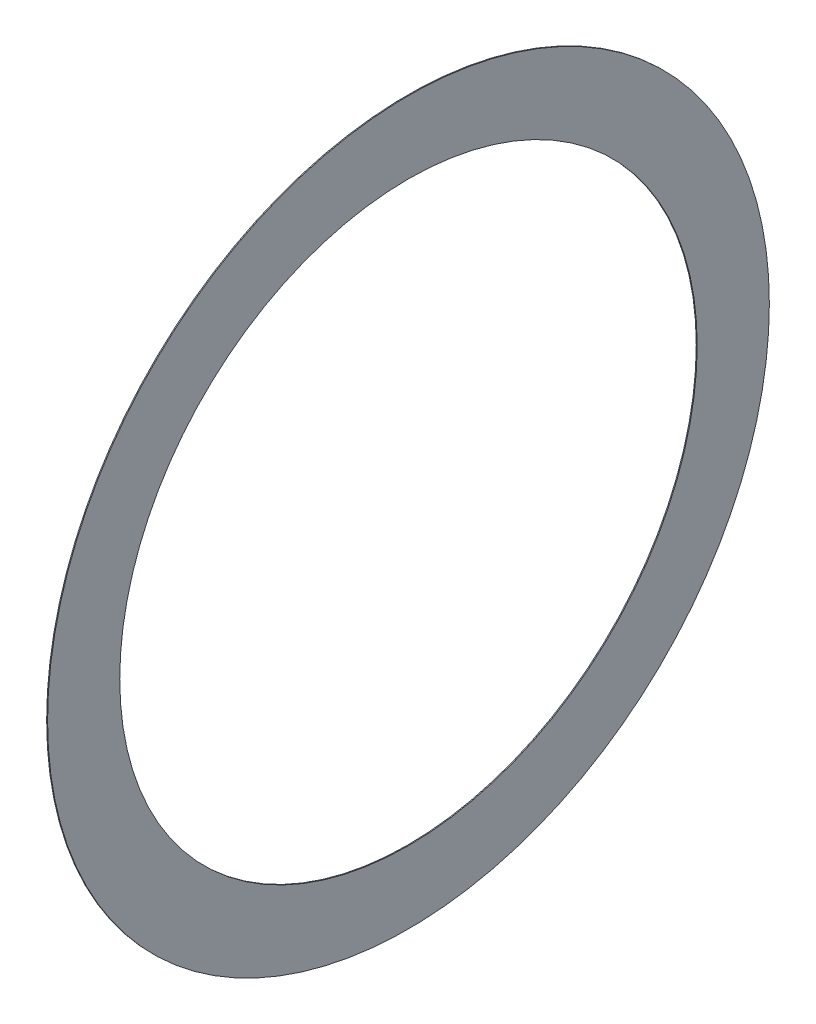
SolidWorks part; units mm, degrees
ref_plane "Face" through (0, 0, 0) normal (0, 0, 1) x (1, 0, 0)
ref_plane "Dessus" through (0, 0, 0) normal (0, 1, 0) x (1, 0, 0)
ref_plane "Droite" through (0, 0, 0) normal (1, 0, 0) x (0, 0, -1)
sketch "Esquisse1" plane through (0, 0, 0) normal (0, 0, 1) x (1, 0, 0)
  line L0 (0, 0) -> (81.871, 0) construction
  line L1 (0, 97.5) -> (0.25, 97.5)
  line L2 (0, 97.5) -> (0, 78)
  line L3 (0, 78) -> (0.25, 78)
  line L4 (0.25, 97.5) -> (0.25, 78)
  dimension "D1" = 97.5
  dimension "D2" = 78
  dimension "D3" = 0.25
revolve "Révolution1" add sketch "Esquisse1" angle 360 about L0
